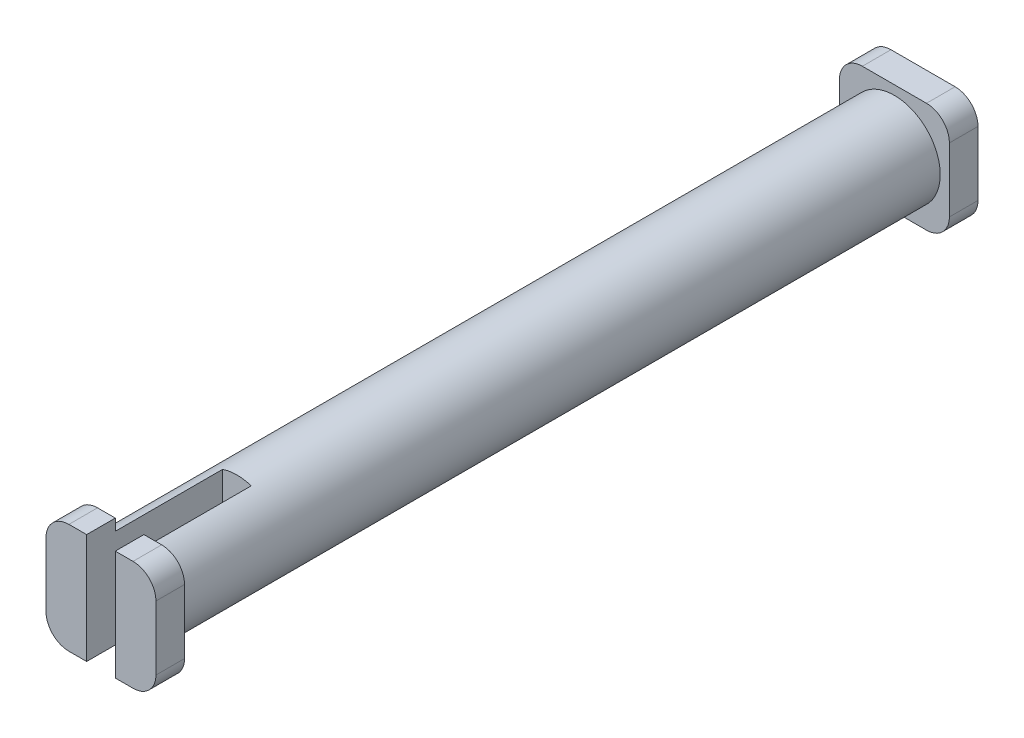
SolidWorks part; units mm, degrees
ref_plane "Front Plane" through (0, 0, 0) normal (0, 0, 1) x (1, 0, 0)
ref_plane "Top Plane" through (0, 0, 0) normal (0, 1, 0) x (1, 0, 0)
ref_plane "Right Plane" through (0, 0, 0) normal (1, 0, 0) x (0, 0, -1)
sketch "Sketch1" plane through (0, 0, 0) normal (0, 0, 1) x (1, 0, 0)
  line L1 (1.27, 0) -> (4.826, 0)
  line L2 (0, 1.27) -> (0, 4.826)
  line L3 (1.27, 6.096) -> (4.826, 6.096)
  line L4 (6.096, 1.27) -> (6.096, 4.826)
  arc A0 (4.826, 0) -> (6.096, 1.27) centre (4.826, 1.27) ccw
  arc A1 (1.27, 0) -> (0, 1.27) centre (1.27, 1.27) cw
  arc A2 (0, 4.826) -> (1.27, 6.096) centre (1.27, 4.826) cw
  arc A3 (4.826, 6.096) -> (6.096, 4.826) centre (4.826, 4.826) cw
  point P7 (6.096, 0)
  point P10 (0, 0)
  point P13 (0, 6.096)
  point P16 (6.096, 6.096)
  dimension "D3" = 1.27
  dimension "D1" = 6.096
  dimension "D2" = 6.096
extrude "Boss-Extrude1" add sketch "Sketch1" along normal blind 1.5875
sketch "Sketch2" plane through (0, 0, 1.5875) normal (0, 0, 1) x (1, 0, 0)
  line L0 (0, 4.826) -> (0, 1.27) construction
  line L1 (4.826, 6.096) -> (1.27, 6.096) construction
  circle A0 centre (3.048, 3.048) radius 2.54
  point P5 (0, 3.048)
  point P9 (3.048, 6.096)
  dimension "D1" = 5.08
extrude "Boss-Extrude2" add sketch "Sketch2" along normal blind 42.418
ref_plane "Plane1" through (0, 0, 22.7965) normal (0, 0, 1) x (1, 0, 0)
mirror "Mirror1" about plane through (0, 0, 22.7965) normal (0, 0, 1) of "Boss-Extrude1"
sketch "Sketch3" plane through (0, 0, 45.593) normal (0, 0, 1) x (1, 0, 0)
  line L0 (4.826, 6.096) -> (1.27, 6.096) construction
  line L1 (2.2543, 6.096) -> (3.8418, 6.096)
  line L2 (2.2543, 6.096) -> (2.2543, 0)
  line L3 (2.2543, 0) -> (3.8418, 0)
  line L4 (3.8418, 6.096) -> (3.8418, 0)
  line L5 (1.27, 0) -> (4.826, 0) construction
  line L6 (3.048, 0) -> (3.048, -0.924) construction
  point P12 (3.048, 0)
  dimension "D1" = 1.5875
extrude "Cut-Extrude1" cut sketch "Sketch3" against normal blind 7.5406
